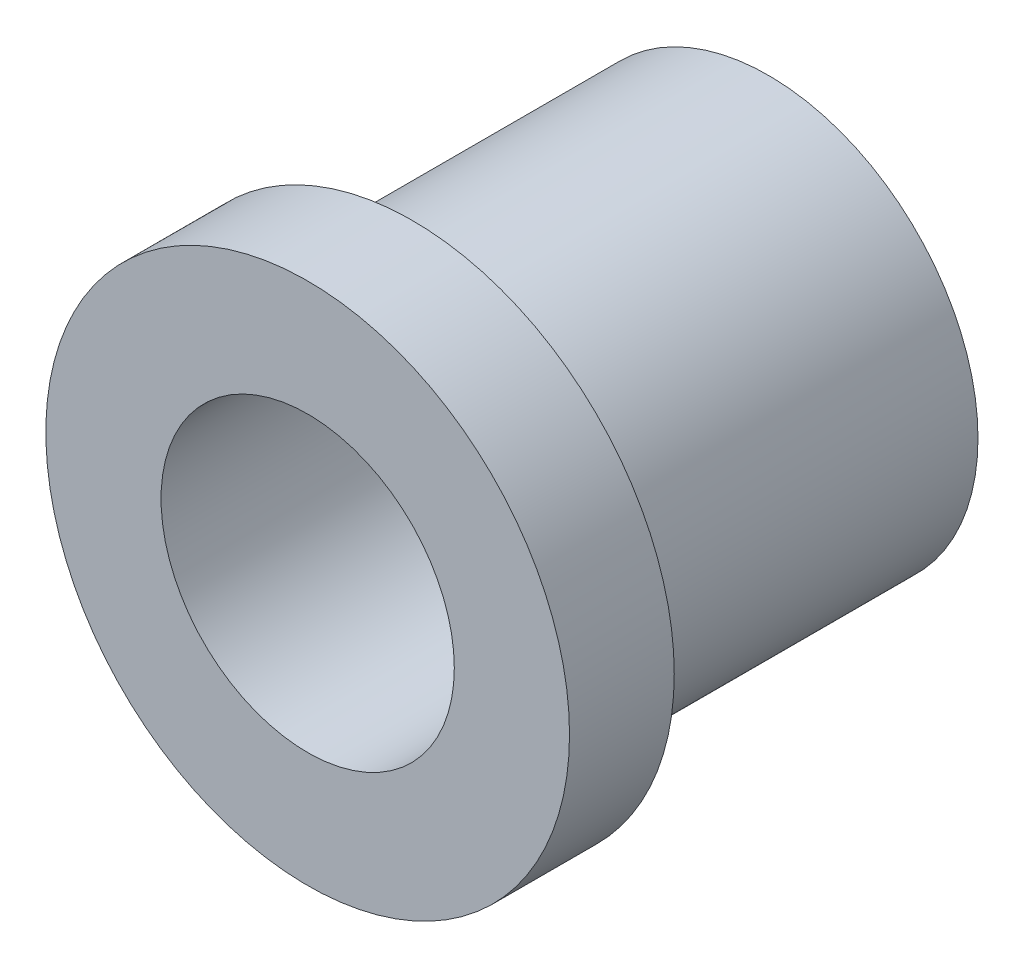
SolidWorks part; units mm, degrees
ref_plane "Plano frontal" through (0, 0, 0) normal (0, 0, 1) x (1, 0, 0)
ref_plane "Plano superior" through (0, 0, 0) normal (0, 1, 0) x (1, 0, 0)
ref_plane "Plano direito" through (0, 0, 0) normal (1, 0, 0) x (0, 0, -1)
sketch "Esboço1" plane through (0, 0, 0) normal (0, 1, 0) x (1, 0, 0)
  line L0 (7, 0) -> (12.5, 0)
  line L1 (12.5, 0) -> (12.5, 5)
  line L2 (12.5, 5) -> (10, 5)
  line L3 (10, 5) -> (10, 22)
  line L4 (10, 22) -> (7, 22)
  line L5 (7, 22) -> (7, 0)
  dimension "D1" = 7
  dimension "D2" = 22
  dimension "D3" = 5
  dimension "D4" = 10
  dimension "D5" = 12.5
ref_axis "Eixo1" through (0, 0, 1.1) along (0, 0, -1)
revolve "Revolução1" add sketch "Esboço1" angle 360 about axis through (0, 0, 1.1) along (0, 0, -1)
